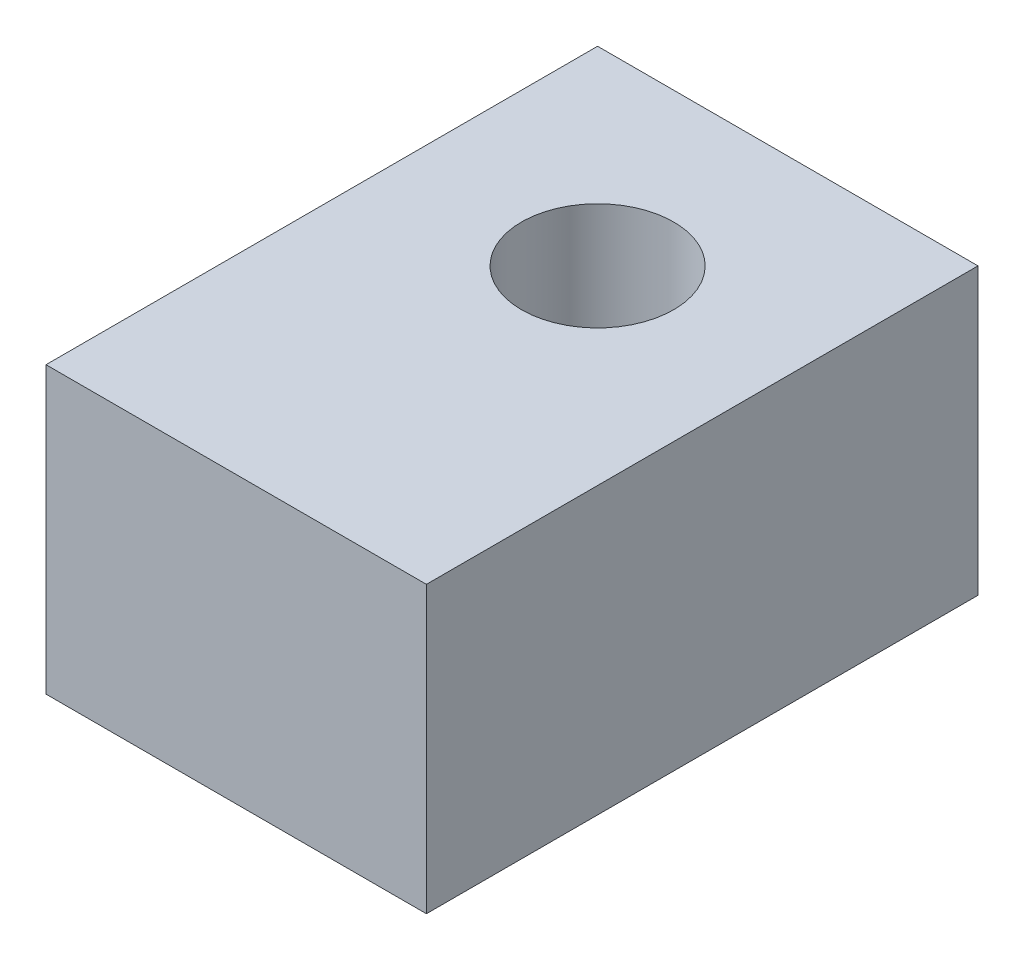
SolidWorks part; units mm, degrees
ref_plane "Alzado" through (0, 0, 0) normal (0, 0, 1) x (1, 0, 0)
ref_plane "Planta" through (0, 0, 0) normal (0, 1, 0) x (1, 0, 0)
ref_plane "Vista lateral" through (0, 0, 0) normal (1, 0, 0) x (0, 0, -1)
sketch "Croquis1" plane through (0, 0, 0) normal (0, 0, 1) x (1, 0, 0)
  line L1 (-20, 15) -> (20, 15)
  line L2 (-20, 15) -> (-20, -15)
  line L3 (-20, -15) -> (20, -15)
  line L4 (20, 15) -> (20, -15)
extrude "Extruir1" add sketch "Croquis1" along normal blind 58
sketch "Croquis2" plane through (0, 15, 0) normal (0, 1, 0) x (1, 0, 0)
  point P0 (0, -20)
hole_wizard "Taladro de diámetro de Ø16.0 (16)1" positions "Croquis3D1" profile "Croquis3" hole size "Ø16.0" standard "ISO"
sketch3d "Croquis3D1"
  point P0 (0, 15, 20)
sketch "Croquis3" plane through (0, 15, 20) normal (1, 0, 0) x (0, 0, 1)
  line L0 (0, 0) -> (0, 30)
  line L1 (0, 30) -> (8, 30)
  line L2 (8, 30) -> (8, 0)
  line L5 (8, 0) -> (0, 0)
  line L11 (0, -6.35) -> (0, 107.95) construction
  dimension "Diámetro de taladro hasta el siguiente" = 16
  dimension "Profundidad de taladro hasta el siguiente" = 30
